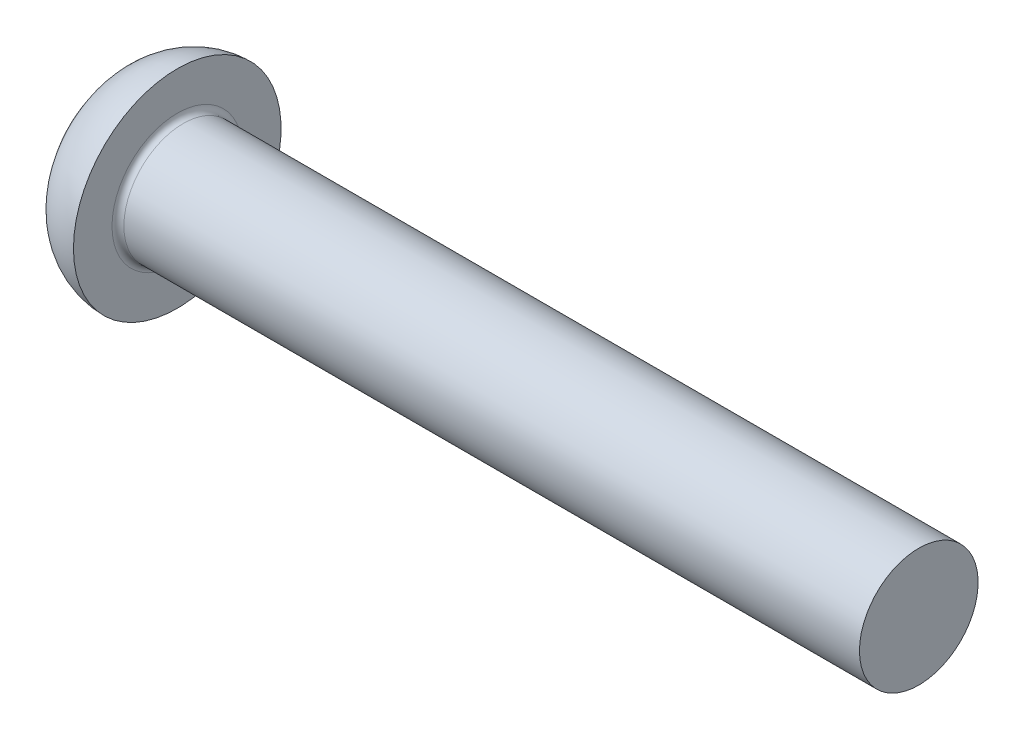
SolidWorks part; units mm, degrees
ref_plane "Front Plane" through (0, 0, 0) normal (0, 0, 1) x (1, 0, 0)
ref_plane "Top Plane" through (0, 0, 0) normal (0, 1, 0) x (1, 0, 0)
ref_plane "Right Plane" through (0, 0, 0) normal (1, 0, 0) x (0, 0, -1)
sketch "BodySke" plane through (0, 0, 0) normal (0, 0, 1) x (1, 0, 0)
  line L0 (0, 0) -> (111.3824, 0) construction
  line L1 (0, 0) -> (0, 8) construction
  line L2 (5.4, 4) -> (5.4, 7)
  line L4 (5.4, 4) -> (55.4, 4)
  line L5 (55.4, 4) -> (55.4, 0)
  line L6 (6.65, 7.824) -> (6.65, -6.8939) construction
  line L7 (0, 0) -> (55.4, 0)
  line L8 (25.4, 8.824) -> (25.4, -4.958) construction
  arc A0 (5.4, 7) -> (1.888, 5.306) centre (5.4541, 2.4003) ccw
  arc A1 (1.888, 5.306) -> (0, 0) centre (8.4, 0) ccw
  point P10 (55.4, 3.4455)
  dimension "Head_side_radius" = 4.6
  dimension "Head_radius" = 8.4
  dimension "Diameter" = 8
  dimension "Head_dia" = 14
  dimension "Head_height" = 5.4
  dimension "Length" = 50
  dimension "Advance" = 1.25
  dimension "Thread_minor" = 6.891
  dimension "Thread_length" = 30
revolve "BaseBody" add sketch "BodySke" angle 360 about L0
fillet "Fillet1" radius 0.4 1 edges at (5.4, 0, 4)
ref_plane "Plane1" through (4.26, 0, 0) normal (1, 0, 0) x (0, 0, -1)
sketch "RecSkeTop" plane through (0, 0, 0) normal (1, 0, 0) x (0, 0, -1)
  line L1 (-0.847, 3.85) -> (0.847, 3.85)
  line L2 (-0.847, 3.85) -> (-0.847, -3.85)
  line L3 (-0.847, -3.85) -> (0.847, -3.85)
  line L4 (0.847, 3.85) -> (0.847, -3.85)
  dimension "D1" = 3.85
  dimension "Cross_dia" = 7.7
  dimension "D2" = 1.694
  dimension "D3" = 0.847
sketch "RecSkeBot" plane through (4.26, 0, 0) normal (1, 0, 0) x (0, 0, -1)
  line L0 (-0.847, 3.85) -> (-0.847, -3.85) construction
  line L1 (-0.847, 1.726) -> (0.847, 1.726)
  line L2 (-0.847, 1.726) -> (-0.847, -1.726)
  line L3 (-0.847, -1.726) -> (0.847, -1.726)
  line L4 (0.847, 1.726) -> (0.847, -1.726)
  line L5 (0.847, 3.85) -> (0.847, -3.85) construction
  dimension "D1" = 3.4521
  dimension "D2" = 1.726
loft "Recess" cut profiles "RecSkeTop", "RecSkeBot"
pattern_circular "RecPat" count 2 every 90 about axis through (0, 0, 0) along (1, 0, 0) of "Recess"
sketch "RecCorSke" plane through (0, 0, 0) normal (0, 0, 1) x (1, 0, 0)
  line L0 (0, 0) -> (57.5987, 0) construction
  line L1 (0, 0) -> (0, 1.8634)
  line L3 (0, 1.8634) -> (4.26, 1.5655)
  line L4 (4.26, 1.5655) -> (4.7687, 0)
  line L5 (4.7687, 0) -> (0, 0)
  dimension "D1" = 18
  dimension "D2" = 4.26
  dimension "D3" = 1.8634
  dimension "D4" = 4
revolve "RecessCore" cut sketch "RecCorSke" angle 360 about L0
sketch "ThdSchSke" plane through (0, 0, 0) normal (0, 0, 1) x (1, 0, 0)
  line L0 (0, 0) -> (55.1256, 0) construction
  line L1 (0, 0) -> (111.3824, 0) construction
  line L2 (55.0799, 4) -> (55.0799, 4.6403)
  line L3 (55.0799, 4.6403) -> (55.7201, 4.6403)
  line L4 (55.7201, 4.6403) -> (55.7201, 4)
  line L5 (55.7201, 4) -> (55.4, 3.4455)
  line L6 (55.4, 3.4455) -> (55.0799, 4)
  line L7 (5.4, 4) -> (55.4, 4) construction
  line L13 (55.4, 4) -> (55.4, 0) construction
revolve "ThreadSchematic" [suppressed] cut sketch "ThdSchSke" angle 360 about L0
pattern_linear "ThdSchPat" [suppressed] count 24 along (1, 0, 0)
equation "\"Thread_minor@ThreadCosmetic\" = \"Thread_minor@BodySke\""
equation "\"D1@RecSkeTop\" = \"Cross_dia@RecSkeTop\" / 2"
equation "\"D2@RecSkeTop\" = \"Cross_dia@RecSkeTop\" * 0.22"
equation "\"D3@RecSkeTop\" = \"D2@RecSkeTop\" / 2"
equation "\"D1@RecSkeBot\" = \"Cross_dia@RecSkeTop\" - 2 * \"Cross_depth@Plane1\" *  tan( 26.5 * 0.017453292 ) "
equation "\"D2@RecSkeBot\" = \"D1@RecSkeBot\" / 2"
equation "\"D2@RecCorSke\" = \"Cross_depth@Plane1\""
equation "\"D3@RecCorSke\" = \"D2@RecSkeTop\" * 1.1"
equation "\"Advance@ThdSchPat\" = \"Advance@BodySke\""
equation "\"D1@ThdSchPat\" =  int( \"Thread_length@BodySke\" / \"Advance@ThdSchPat\" ) "
